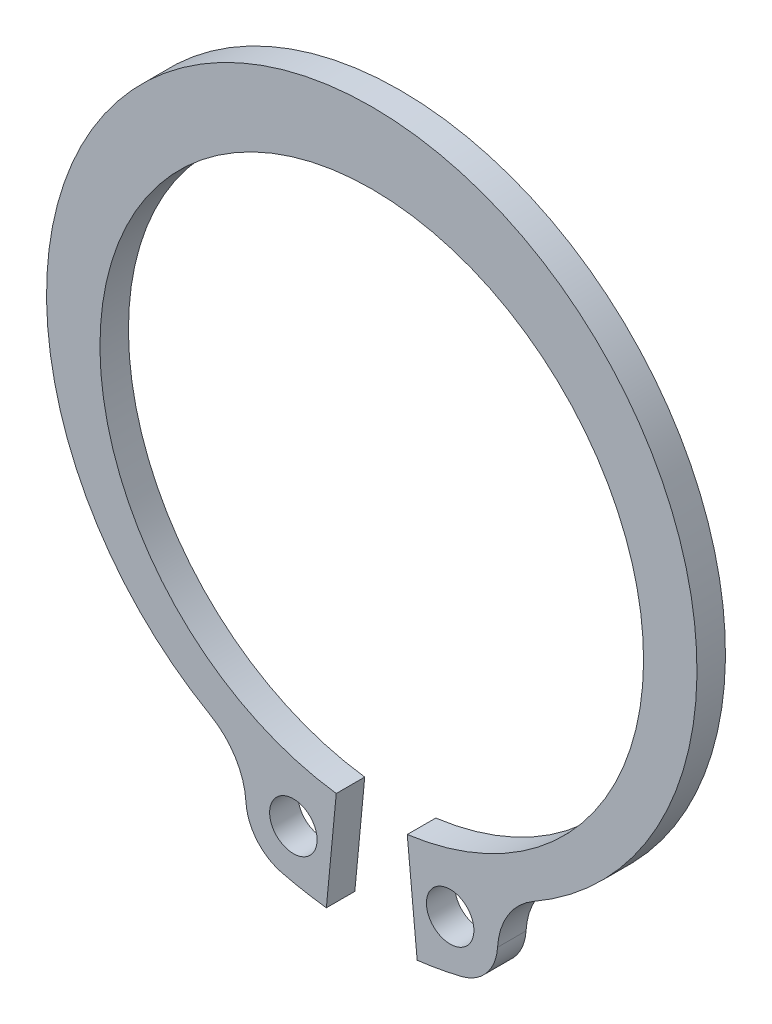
SolidWorks part; units mm, degrees
ref_plane "Face" through (0, 0, 0) normal (0, 0, 1) x (1, 0, 0)
ref_plane "Dessus" through (0, 0, 0) normal (0, 1, 0) x (1, 0, 0)
ref_plane "Droite" through (0, 0, 0) normal (1, 0, 0) x (0, 0, -1)
sketch "Esquisse1" plane through (0, 0, 0) normal (0, 0, 1) x (1, 0, 0)
  line L0 (0, 14.45) -> (0, 11.45) construction
  line L1 (1.4954, -11.3519) -> (1.9124, -15.7321)
  line L2 (-1.4954, -11.3519) -> (-1.9124, -15.7321)
  line L3 (0.4, -11.0928) -> (0.4, -15.4928) construction
  line L4 (-0.4, -11.0928) -> (-0.4, -15.4928) construction
  arc A0 (1.4954, -11.3519) -> (-1.4954, -11.3519) centre (0, 0) ccw
  arc A1 (6.8036, -11.1412) -> (-6.8036, -11.1412) centre (0, 0.75) ccw
  arc A2 (1.9124, -15.7321) -> (3.7791, -15.3907) centre (0, 0) ccw
  circle A3 centre (3.3022, -13.4484) radius 1
  arc A4 (3.7791, -15.3907) -> (5.2987, -13.5671) centre (3.3022, -13.4484) ccw
  arc A5 (6.8036, -11.1412) -> (5.2987, -13.5671) centre (8.2934, -13.7452) ccw
  circle A6 centre (-3.3022, -13.4484) radius 1
  arc A7 (-6.8036, -11.1412) -> (-5.2987, -13.5671) centre (-8.2934, -13.7452) cw
  arc A8 (-3.7791, -15.3907) -> (-5.2987, -13.5671) centre (-3.3022, -13.4484) cw
  arc A9 (-1.9124, -15.7321) -> (-3.7791, -15.3907) centre (0, 0) cw
  arc A10 (0.4, -11.0928) -> (-0.4, -11.0928) centre (0, 0) ccw construction
  circle A11 centre (0, 0) radius 12 construction
  dimension "dgorge" = 22.9
  dimension "D3" = 0.75
  dimension "dtrou" = 2
  dimension "D8" = 2
  dimension "D9" = 3
  dimension "dint" = 22.2
  dimension "dn" = 24
  dimension "b" = 3
  dimension "a" = 4.4
  dimension "D5" = 15.008
  dimension "D7" = 1.6
  dimension "D12" = 0.8
  dimension "D13" = 4.13
  dimension "D14" = 5.439
extrude "Base-Extrusion" add sketch "Esquisse1" along normal blind 1.2
equation "\"D3@Esquisse1\" = \"b@Esquisse1\"/4"
equation "\"D7@Esquisse1\"=\"dtrou@Esquisse1\"*0.8"
equation "\"D8@Esquisse1\" = \"dtrou@Esquisse1\""
equation "\"D9@Esquisse1\" = \"dtrou@Esquisse1\"*1.5"
equation "\"D12@Esquisse1\" = \"dtrou@Esquisse1\"*0.4"
equation "\"D5@Esquisse1\" = 360-(360-\"D13@Esquisse1\")*\"dint@Esquisse1\"/\"dgorge@Esquisse1\""
equation "\"D14@Esquisse1\" = (\"D5@Esquisse1\"-\"D13@Esquisse1\")/2"
